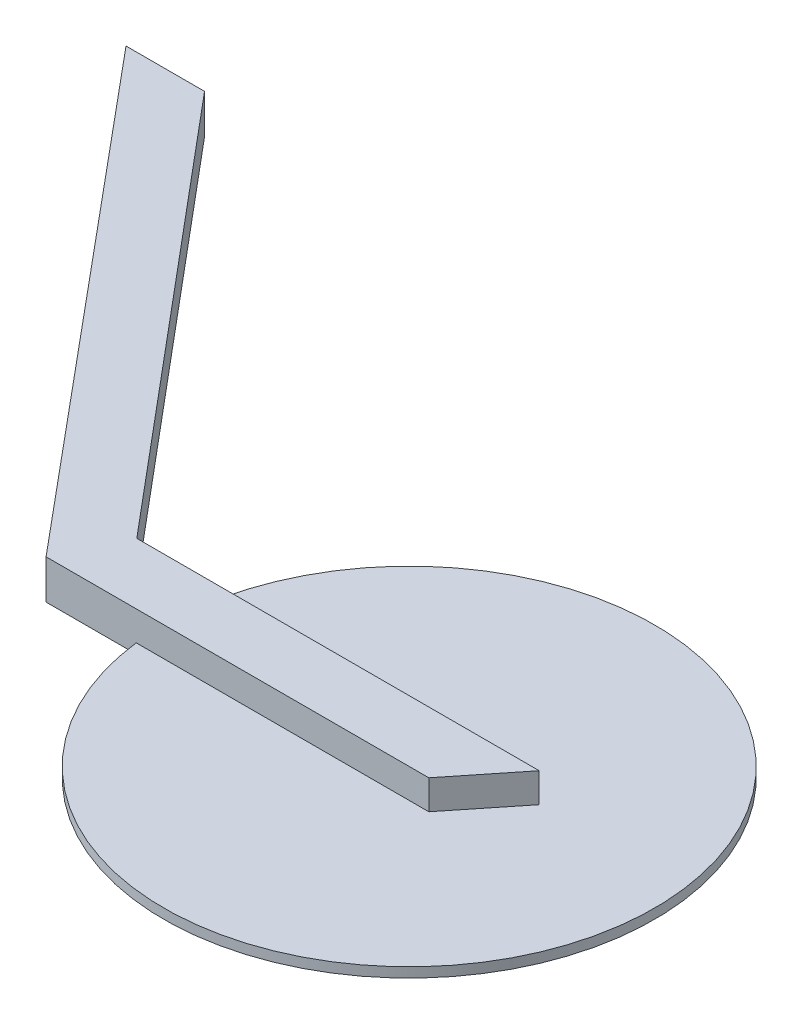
SolidWorks part; units mm, degrees
ref_plane "Plan de face" through (0, 0, 0) normal (0, 0, 1) x (1, 0, 0)
ref_plane "Plan de dessus" through (0, 0, 0) normal (0, 1, 0) x (1, 0, 0)
ref_plane "Plan de droite" through (0, 0, 0) normal (1, 0, 0) x (0, 0, -1)
sketch "Esquisse1" plane through (0, 0, 0) normal (0, 1, 0) x (1, 0, 0)
  line L6 (0, 0) -> (8, 0)
  line L7 (8, 0) -> (43.9953, -42.8976)
  line L12 (43.9953, -42.8976) -> (84.9953, -42.8976)
  line L13 (84.9953, -42.8976) -> (79.9978, -49.1445)
  line L14 (79.9978, -49.1445) -> (40.9978, -49.1445)
  line L15 (40.9978, -49.1445) -> (0, 0)
  point P8 (94.6504, -47.3335)
  point P11 (93.2973, -47.6967)
  point P12 (0, 0)
  dimension "D1" = 55.9988
  dimension "D2" = 64
  dimension "D3" = 41
  dimension "D4" = 39
  dimension "D5" = 8
  dimension "D6" = 8
  dimension "D7" = 130
extrude "Boss.-Extru.1" add sketch "Esquisse1" along normal blind 4 contours L15 L6 L7 L12 L13 L14
sketch "Esquisse2" plane through (0, 0, 0) normal (0, -1, 0) x (1, 0, 0)
  line L0 (79.9978, 49.1445) -> (40.9978, 49.1445) construction
  circle A0 centre (75, 46.1445) radius 25
  dimension "D2" = 50
  dimension "D1" = 3
  dimension "D3" = 75
extrude "Boss.-Extru.2" add sketch "Esquisse2" against normal blind 1 contours A0
